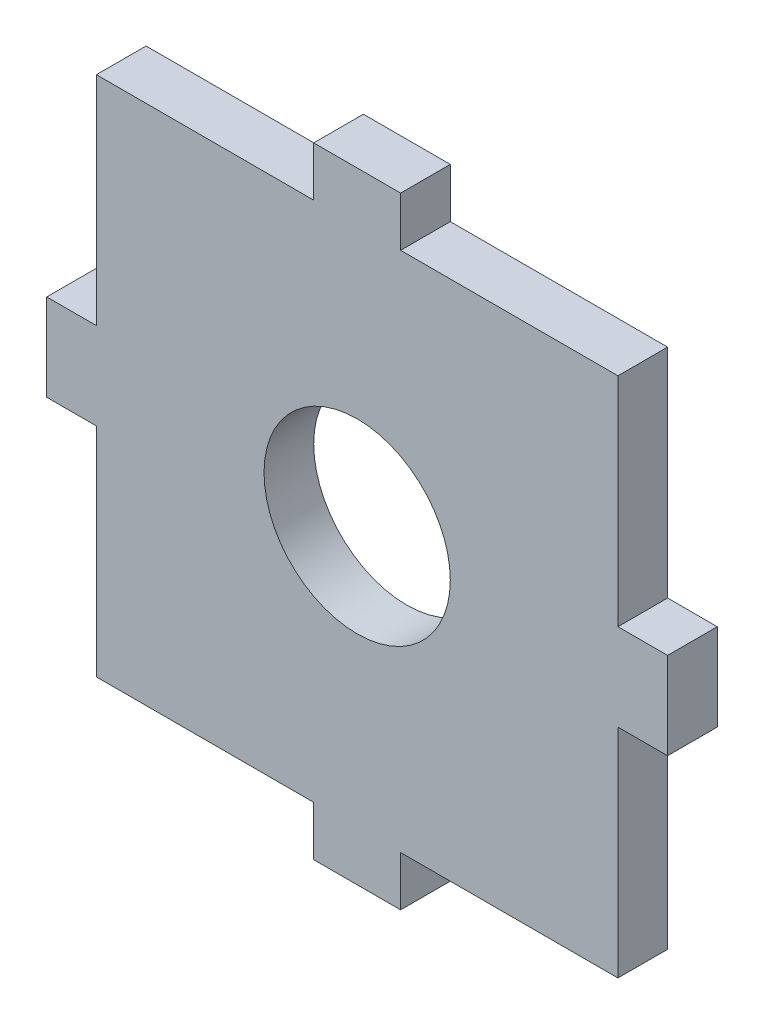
SolidWorks part; units mm, degrees
ref_plane "Front Plane" through (0, 0, 0) normal (0, 0, 1) x (1, 0, 0)
ref_plane "Top Plane" through (0, 0, 0) normal (0, 1, 0) x (1, 0, 0)
ref_plane "Right Plane" through (0, 0, 0) normal (1, 0, 0) x (0, 0, -1)
sketch "Sketch2" plane through (0, 0, 0) normal (0, 0, 1) x (1, 0, 0)
  line L0 (17.361, -10.8647) -> (21.361, -10.8647)
  line L1 (-24.6373, 6.6353) -> (-7.1373, 6.6353)
  line L2 (-24.6373, 6.6353) -> (-24.6373, -10.8647)
  line L3 (-24.6373, -35.3647) -> (-7.1373, -35.3647)
  line L4 (17.361, 6.6353) -> (17.361, -10.8647)
  line L5 (-24.6373, 6.6353) -> (17.361, -35.3647) construction
  line L6 (-24.6373, -35.3647) -> (17.361, 6.6353) construction
  line L7 (-24.6373, -17.8647) -> (-24.6373, -35.3647)
  line L8 (-7.1373, -35.3647) -> (-7.1373, -39.3647)
  line L9 (-7.1373, -39.3647) -> (-0.139, -39.3647)
  line L10 (-0.139, -35.3647) -> (-0.139, -39.3647)
  line L11 (17.361, -17.8647) -> (17.361, -35.3647)
  line L12 (-7.1373, 6.629) -> (-7.1373, 10.629)
  line L14 (-7.1373, 10.629) -> (-0.1373, 10.629)
  line L17 (-0.139, 6.629) -> (-0.1373, 10.629)
  line L18 (-0.139, 6.6353) -> (17.361, 6.6353)
  line L19 (-28.6373, -10.8647) -> (-24.6373, -10.8647)
  line L20 (-28.6373, -10.8647) -> (-28.6373, -17.8647)
  line L21 (-28.6373, -17.8647) -> (-24.6373, -17.8647)
  line L26 (17.361, -17.8647) -> (21.361, -17.8647)
  line L27 (21.361, -10.8647) -> (21.361, -17.8647)
  line L30 (-0.139, -35.3647) -> (17.361, -35.3647)
  circle A0 centre (-3.6382, -14.3647) radius 7.5
  point P0 (-3.6382, -14.3647)
  point P5 (-4.0489, -59.3647)
  point P19 (-27.0489, -14.3457)
  point P26 (18.9511, -14.3457)
  dimension "D2" = 42
extrude "Boss-Extrude2" add sketch "Sketch2" along normal blind 4
